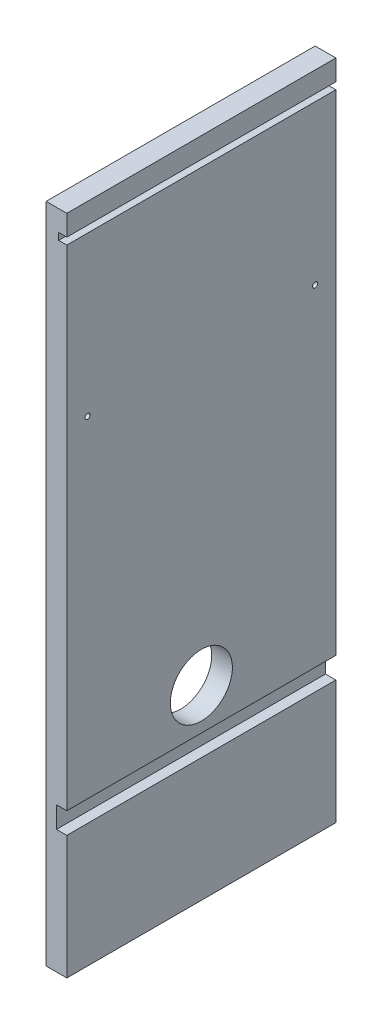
SolidWorks part; units mm, degrees
ref_plane "Face" through (0, 0, 0) normal (0, 0, 1) x (1, 0, 0)
ref_plane "Dessus" through (0, 0, 0) normal (0, 1, 0) x (1, 0, 0)
ref_plane "Droite" through (0, 0, 0) normal (1, 0, 0) x (0, 0, -1)
sketch "Esquisse1" plane through (0, 0, 0) normal (0, 0, 1) x (1, 0, 0)
  line L0 (-16.8461, -13.3) -> (-16.8461, -250)
  line L1 (-26.8461, 0) -> (-16.8461, 0)
  line L2 (-26.8461, 0) -> (-26.8461, -320)
  line L3 (-26.8461, -320) -> (-16.8461, -320)
  line L4 (-16.8461, 0) -> (-16.8461, -10)
  line L5 (-20.7739, -10) -> (-16.8461, -10)
  line L6 (-20.7739, -10) -> (-20.7739, -13.3)
  line L7 (-20.7739, -13.3) -> (-16.8461, -13.3)
  line L8 (-16.8461, -260.3) -> (-16.8461, -320)
  line L9 (-16.8461, -250) -> (-21.8461, -250)
  line L11 (-16.8461, -260.3) -> (-21.8461, -260.3)
  line L12 (-21.8461, -250) -> (-21.8461, -260.3)
  dimension "D1" = 10
  dimension "D2" = 320
  dimension "D3" = 3.3
  dimension "D4" = 10
  dimension "D5" = 10.3
  dimension "D6" = 70
  dimension "D7" = 5
extrude "Base-Extrusion" add sketch "Esquisse1" along normal blind 130
sketch "Esquisse2" plane through (-26.8461, 0, 0) normal (-1, 0, 0) x (0, 0, 1)
  line L0 (130, -320) -> (0, -320) construction
  line L1 (0, 0) -> (0, -320) construction
  circle A0 centre (65, -230) radius 15
  circle A1 centre (10, -90) radius 1.25
  circle A2 centre (120, -90) radius 1.25
  dimension "D1" = 90
  dimension "D2" = 110
  dimension "D3" = 10
  dimension "D5" = 65
  dimension "D4" = 230
extrude "Enlèv. mat.-Extru.1" cut sketch "Esquisse2" against normal through all
sketch "Esquisse4" plane through (0, -320, 0) normal (0, -1, 0) x (1, 0, 0)
  line L0 (-16.8461, 65) -> (-26.8461, 65) construction
  circle A0 centre (-21.4686, 65) radius 2.5
extrude "Enlèv. mat.-Extru.2" cut sketch "Esquisse4" against normal blind 8
